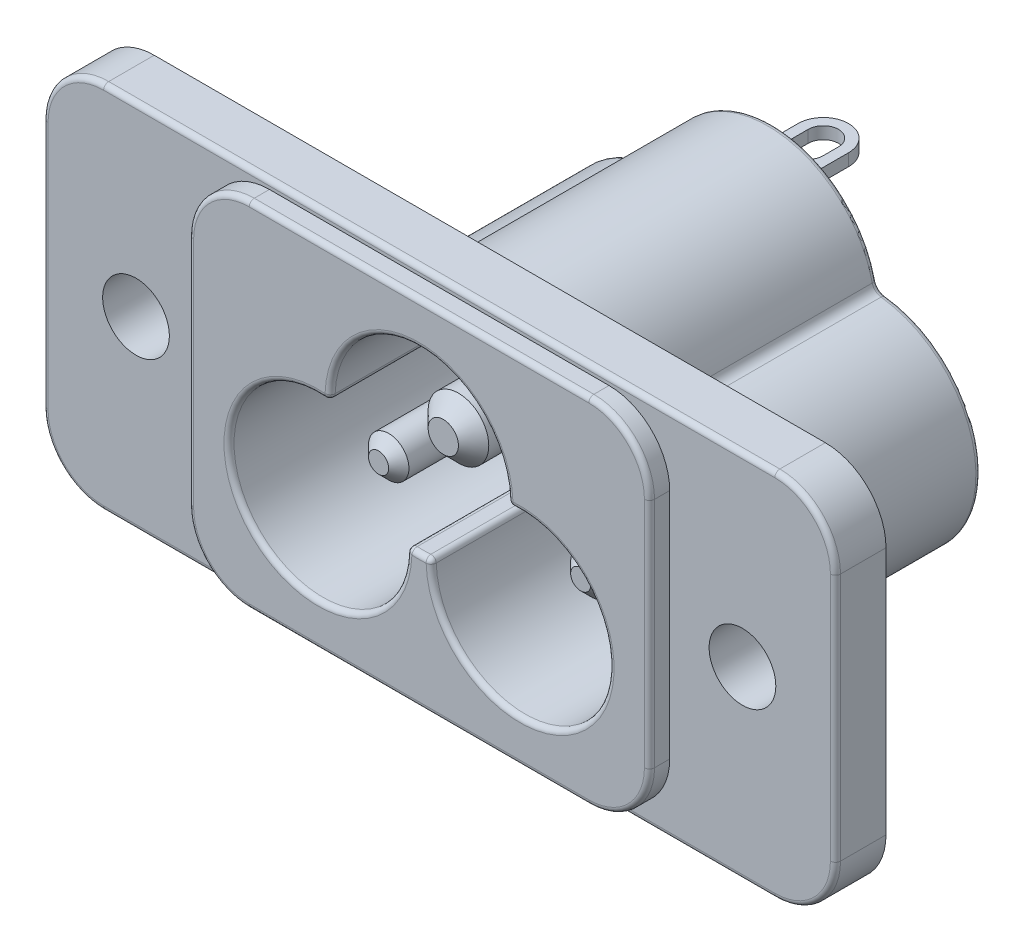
SolidWorks part; units mm, degrees
ref_plane "Front Plane" through (0, 0, 0) normal (0, 0, 1) x (1, 0, 0)
ref_plane "Top Plane" through (0, 0, 0) normal (0, 1, 0) x (1, 0, 0)
ref_plane "Right Plane" through (0, 0, 0) normal (1, 0, 0) x (0, 0, -1)
sketch "Sketch1" plane through (0, 0, 0) normal (0, 0, 1) x (1, 0, 0)
  line L0 (0, 9.15) -> (39.2, 9.15) construction
  line L1 (3, 0) -> (36.2, 0)
  line L2 (0, 3) -> (0, 15.3)
  line L3 (3, 18.3) -> (36.2, 18.3)
  line L4 (39.2, 3) -> (39.2, 15.3)
  line L5 (19.6, 18.3) -> (19.6, 0) construction
  line L6 (4.6, 18.3) -> (4.6, 0) construction
  line L7 (34.6, 18.3) -> (34.6, 0) construction
  arc A0 (39.2, 15.3) -> (36.2, 18.3) centre (36.2, 15.3) ccw
  arc A1 (36.2, 0) -> (39.2, 3) centre (36.2, 3) ccw
  arc A2 (0, 3) -> (3, 0) centre (3, 3) ccw
  arc A3 (0, 15.3) -> (3, 18.3) centre (3, 15.3) cw
  circle A4 centre (4.6, 9.15) radius 1.65
  circle A5 centre (34.6, 9.15) radius 1.65
  point P7 (39.2, 18.3)
  point P10 (39.2, 0)
  point P13 (0, 0)
  point P16 (0, 18.3)
  dimension "D3" = 3
  dimension "D6" = 3.3
  dimension "D7" = 3.3
  dimension "D1" = 39.2
  dimension "D2" = 18.3
  dimension "D4" = 15
  dimension "D5" = 15
extrude "Extrude1" add sketch "Sketch1" along normal blind 2.5
sketch "Sketch2" plane through (0, 0, 2.5) normal (0, 0, 1) x (1, 0, 0)
  line L0 (36.2, 18.3) -> (3, 18.3) construction
  line L1 (11.2, 17.9) -> (28, 17.9)
  line L2 (8.2, 14.9) -> (8.2, 3.4)
  line L3 (11.2, 0.4) -> (28, 0.4)
  line L4 (31, 14.9) -> (31, 3.4)
  line L5 (3, 0) -> (36.2, 0) construction
  line L6 (8.2, 9.15) -> (31, 9.15) construction
  line L7 (19.6, 18.3) -> (19.6, 0) construction
  arc A0 (8.2, 14.9) -> (11.2, 17.9) centre (11.2, 14.9) cw
  arc A1 (11.2, 0.4) -> (8.2, 3.4) centre (11.2, 3.4) cw
  arc A2 (31, 3.4) -> (28, 0.4) centre (28, 3.4) cw
  arc A3 (31, 14.9) -> (28, 17.9) centre (28, 14.9) ccw
  point P10 (19.6, 9.15)
  point P15 (8.2, 17.9)
  point P22 (31, 17.9)
  dimension "D4" = 3
  dimension "D1" = 0.4
  dimension "D2" = 0.4
  dimension "D3" = 22.8
extrude "Extrude2" add sketch "Sketch2" along normal blind 1
sketch "Sketch3" plane through (0, 0, 3.5) normal (0, 0, 1) x (1, 0, 0)
  line L0 (8.2, 9.15) -> (14.6, 9.15) construction
  line L1 (8.2, 14.9) -> (8.2, 3.4) construction
  line L2 (31, 3.4) -> (31, 14.9) construction
  line L3 (8.2, 11.4) -> (15.4, 11.4) construction
  line L4 (8.2, 14.9) -> (8.2, 3.4) construction
  line L5 (8.2, 6.9) -> (31, 6.9) construction
  line L6 (31, 3.4) -> (31, 14.9) construction
  line L7 (19.6, 17.9) -> (19.6, 11.4) construction
  line L8 (28, 17.9) -> (11.2, 17.9) construction
  line L9 (11.2, 0.4) -> (28, 0.4) construction
  line L10 (14.6, 17.9) -> (14.6, 0.4) construction
  line L11 (11.2, 0.4) -> (28, 0.4) construction
  line L12 (24.6, 17.9) -> (24.6, 0.4) construction
  line L13 (19.6, 11.4) -> (31, 11.4) construction
  line L14 (19.6, 9.15) -> (23.1465, 9.15) construction
  line L15 (19.6, 9.15) -> (19.6, 0.4) construction
  line L16 (24.6, 9.15) -> (31, 9.15) construction
  arc A0 (18.7827, 7.2803) -> (20.4173, 7.2803) centre (19.6, 11.4) ccw
  arc A1 (15.4173, 11.0197) -> (18.7827, 7.2803) centre (14.6, 6.9) ccw
  arc A2 (20.4173, 7.2803) -> (23.7827, 11.0197) centre (24.6, 6.9) ccw
  arc A3 (23.7827, 11.0197) -> (15.4173, 11.0197) centre (19.6, 11.4) ccw
  dimension "D5" = 8.4
  dimension "D6" = 8.4
  dimension "D7" = 8.4
  dimension "D1" = 2.25
  dimension "D2" = 2.25
  dimension "D3" = 5
  dimension "D4" = 5
sketch "Sketch4" plane through (0, 0, 0) normal (0, 0, -1) x (-1, 0, 0)
  line L0 (-29.9, 6.9) -> (-29.9, 21.5276) construction
  line L2 (-9.3, 6.9) -> (-9.3, 20.7804) construction
  arc A2 (-18.7827, 7.2803) -> (-15.4173, 11.0197) centre (-14.6, 6.9) ccw construction
  arc A5 (-15.4173, 11.0197) -> (-23.7827, 11.0197) centre (-19.6, 11.4) ccw construction
  arc A6 (-14.3091, 11.0899) -> (-15.4173, 11.0197) centre (-14.6, 6.9) ccw construction
  arc A9 (-15.4173, 11.0197) -> (-23.7827, 11.0197) centre (-19.6, 11.4) ccw construction
  arc A10 (-14.3218, 10.9201) -> (-14.3091, 11.0899) centre (-19.6, 11.4) ccw
  arc A11 (-24.8401, 12.1946) -> (-19.6, 5.1422) centre (-24.6, 6.9) ccw
  arc A15 (-14.3599, 12.1946) -> (-24.8401, 12.1946) centre (-19.6, 11.4) ccw
  arc A16 (-14.3218, 10.9201) -> (-24.8401, 12.1946) centre (-19.6, 11.4) ccw construction
  arc A17 (-23.7827, 11.0197) -> (-20.4173, 7.2803) centre (-24.6, 6.9) ccw construction
  arc A18 (-19.6, 5.1422) -> (-14.3599, 12.1946) centre (-14.6, 6.9) ccw
  arc A20 (-24.8401, 12.1946) -> (-19.3218, 7.3799) centre (-24.6, 6.9) ccw construction
  dimension "D1" = 1.1
extrude "Extrude3" add sketch "Sketch4" along normal blind 14 contours A15 A11 A18
fillet "Fillet1" radius 0.5 3 edges at (24.8401, 12.1946, -7) (19.6, 5.1422, -7) (14.3599, 12.1946, -7)
sketch "Sketch5" plane through (0, 0, 3.5) normal (0, 0, 1) x (1, 0, 0)
  arc A0 (20.4173, 7.2803) -> (23.7827, 11.0197) centre (24.6, 6.9) ccw construction
  arc A1 (18.7827, 7.2803) -> (20.4173, 7.2803) centre (19.6, 11.4) ccw construction
  arc A2 (15.4173, 11.0197) -> (18.7827, 7.2803) centre (14.6, 6.9) ccw construction
  arc A3 (23.7827, 11.0197) -> (15.4173, 11.0197) centre (19.6, 11.4) ccw construction
  arc A4 (20.4173, 7.2803) -> (23.7827, 11.0197) centre (24.6, 6.9) ccw construction
  arc A5 (18.7827, 7.2803) -> (20.4173, 7.2803) centre (19.6, 11.4) ccw construction
  arc A6 (15.4173, 11.0197) -> (18.7827, 7.2803) centre (14.6, 6.9) ccw construction
  arc A7 (23.7827, 11.0197) -> (15.4173, 11.0197) centre (19.6, 11.4) ccw construction
  arc A8 (23.9977, 11.2586) -> (15.2023, 11.2586) centre (19.6, 11.4) ccw
  arc A9 (15.2023, 11.2586) -> (18.9977, 7.0414) centre (14.6, 6.9) ccw
  arc A10 (18.9977, 7.0414) -> (20.2023, 7.0414) centre (19.6, 11.4) ccw
  arc A11 (20.2023, 7.0414) -> (23.9977, 11.2586) centre (24.6, 6.9) ccw
  dimension "D1" = 0.2
extrude "Cut-Extrude1" cut sketch "Sketch5" against normal blind 11.8
fillet "Fillet2" radius 0.25 40 edges at (19.6, 7, -8.3) (11.3295, 3.9566, -8.3) (19.6, 15.8, -8.3) (27.8705, 3.9566, -8.3) (23.9977, 11.2586, -2.4) (15.2023, 11.2586, -2.4) (18.9977, 7.0414, -2.4) (20.2023, 7.0414, -2.4) (27.8705, 3.9566, 3.5) (11.3295, 3.9566, 3.5) (19.6, 15.8, 3.5) (19.6, 7, 3.5) (14.2735, 12.2906, 0) (10.1574, 4.0098, 0) (19.6, 4.4606, 0) (29.0426, 4.0098, 0) (24.9265, 12.2906, 0) (14.2735, 12.2906, -14) (10.1574, 4.0098, -14) (19.6, 4.4606, -14) (29.0426, 4.0098, -14) (24.9265, 12.2906, -14) (38.3213, 17.4213, 2.5) (39.2, 9.15, 2.5) (38.3213, 0.8787, 2.5) (19.6, 0, 2.5) (0.8787, 0.8787, 2.5) (0, 9.15, 2.5) (0.8787, 17.4213, 2.5) (19.6, 16.7, 0) (19.6, 16.7, -14) (19.6, 18.3, 2.5) (30.1213, 17.0213, 3.5) (31, 9.15, 3.5) (30.1213, 1.2787, 3.5) (19.6, 0.4, 3.5) (9.0787, 1.2787, 3.5) (8.2, 9.15, 3.5) (9.0787, 17.0213, 3.5) (19.6, 17.9, 3.5)
sketch "Sketch6" plane through (0, 0, -8.3) normal (0, 0, 1) x (1, 0, 0)
  circle A0 centre (14.6, 6.9) radius 1
  circle A1 centre (19.6, 11.4) radius 1.5
  circle A2 centre (24.6, 6.9) radius 1
  dimension "D1" = 2
  dimension "D2" = 2
  dimension "D3" = 3
extrude "Extrude4" add sketch "Sketch6" along normal blind 10.6
sketch "Sketch7" plane through (0, 0, 3.5) normal (0, 0, 1) x (1, 0, 0)
  circle A0 centre (14.6, 6.9) radius 1
  circle A1 centre (24.6, 6.9) radius 1
extrude "Cut-Extrude2" cut sketch "Sketch7" against normal blind 3
chamfer "Chamfer1" distance 0.75 angle 45 1 edges at (21.1, 11.4, 2.3)
chamfer "Chamfer2" distance 0.5 angle 45 2 edges at (15.6, 6.9, 0.5) (25.6, 6.9, 0.5)
ref_plane "Plane1" through (0, -2.5, 0) normal (0, -1, 0) x (1, 0, 0)
sketch "Sketch8" plane through (0, -2.5, 0) normal (0, -1, 0) x (1, 0, 0)
  line L0 (3.6712, -10.6) -> (37.5489, -10.6) construction
  line L1 (3, 0) -> (36.2, 0) construction
  line L2 (3.6712, -11.2) -> (36.9288, -11.2) construction
  line L3 (19.6, 2.25) -> (19.6, -18.1663) construction
  line L4 (36.2, 2.25) -> (3, 2.25) construction
  line L5 (12.6, -10.6) -> (12.6, -11.2) construction
  line L6 (18.9, -10.6) -> (20.3, -10.6)
  line L7 (18.9, -10.6) -> (18.9, -11.2)
  line L8 (18.9, -11.2) -> (20.3, -11.2)
  line L9 (20.3, -10.6) -> (20.3, -11.2)
  line L10 (11.9, -10.6) -> (13.3, -10.6)
  line L11 (11.9, -10.6) -> (11.9, -11.2)
  line L12 (11.9, -11.2) -> (13.3, -11.2)
  line L13 (13.3, -10.6) -> (13.3, -11.2)
  line L14 (25.9, -10.6) -> (27.3, -10.6)
  line L15 (25.9, -10.6) -> (25.9, -11.2)
  line L16 (25.9, -11.2) -> (27.3, -11.2)
  line L17 (27.3, -10.6) -> (27.3, -11.2)
  line L18 (26.6, -10.6) -> (26.6, -11.2) construction
  point P26 (19.6, -10.6)
  dimension "D1" = 10.6
  dimension "D2" = 0.6
  dimension "D3" = 1.4
  dimension "D4" = 1.4
  dimension "D5" = 1.4
  dimension "D6" = 7
  dimension "D7" = 7
extrude "Extrude5" add sketch "Sketch8" against normal up to body separate body
fillet "Fillet3" radius 0.7 6 edges at (27.3, -2.5, -10.9) (25.9, -2.5, -10.9) (18.9, -2.5, -10.9) (20.3, -2.5, -10.9) (13.3, -2.5, -10.9) (11.9, -2.5, -10.9)
sketch "Sketch9" plane through (0, 0, -14) normal (0, 0, -1) x (-1, 0, 0)
  line L0 (-19.6, 18.3) -> (-19.6, -6.3618) construction
  line L1 (-36.2, 18.3) -> (-3, 18.3) construction
  line L2 (-28.339, 14.8) -> (-11.4133, 14.8) construction
  line L4 (-20.85, 14.8) -> (-18.35, 14.8)
  line L5 (-20.85, 14.8) -> (-20.85, 14.2)
  line L6 (-20.85, 14.2) -> (-18.35, 14.2)
  line L7 (-18.35, 14.8) -> (-18.35, 14.2)
  point P10 (-19.6, 14.2)
  dimension "D1" = 3.5
  dimension "D2" = 2.5
  dimension "D3" = 0.6
extrude "Extrude6" add sketch "Sketch9" along normal blind 3.75
fillet "Fillet4" radius 1.25 2 edges at (20.85, 14.5, -17.75) (18.35, 14.5, -17.75)
sketch "Sketch10" plane through (0, 14.8, 0) normal (0, 1, 0) x (1, 0, 0)
  line L0 (20.85, 16.5) -> (20.85, 14) construction
  line L1 (18.35, 16.5) -> (18.35, 14) construction
  line L2 (20.85, 16.5) -> (20.85, 14) construction
  line L3 (18.35, 16.5) -> (18.35, 15) construction
  line L4 (20.35, 16.5) -> (20.35, 15.74)
  line L5 (18.85, 16.5) -> (18.85, 15.74)
  line L6 (19.59, 15) -> (19.61, 15)
  line L7 (18.35, 16.5) -> (18.35, 14) construction
  line L8 (18.85, 16.5) -> (18.85, 14) construction
  line L9 (20.35, 16.5) -> (20.35, 14) construction
  arc A0 (20.85, 16.5) -> (19.6, 17.75) centre (19.6, 16.5) ccw construction
  arc A1 (19.6, 17.75) -> (18.35, 16.5) centre (19.6, 16.5) ccw construction
  arc A2 (20.85, 16.5) -> (19.6, 17.75) centre (19.6, 16.5) ccw construction
  arc A3 (19.6, 17.75) -> (18.35, 16.5) centre (19.6, 16.5) ccw construction
  arc A4 (20.35, 16.5) -> (19.6, 17.25) centre (19.6, 16.5) ccw
  arc A5 (19.6, 17.25) -> (18.85, 16.5) centre (19.6, 16.5) ccw
  arc A6 (19.59, 15) -> (18.85, 15.74) centre (19.59, 15.74) cw
  arc A7 (19.61, 15) -> (20.35, 15.74) centre (19.61, 15.74) ccw
  dimension "D3" = 0.74
  dimension "D4" = 0.74
  dimension "D2" = 2.25
  dimension "D1" = 0.5
extrude "Cut-Extrude3" cut sketch "Sketch10" against normal up to next
sketch "Sketch12" plane through (0, 0, -14) normal (0, 0, -1) x (-1, 0, 0)
  text T0 "E" font "Century Gothic" height 2
  text T1 "N            L" font "Century Gothic" height 2
extrude "Extrude7" add sketch "Sketch12" along normal blind 0.1
